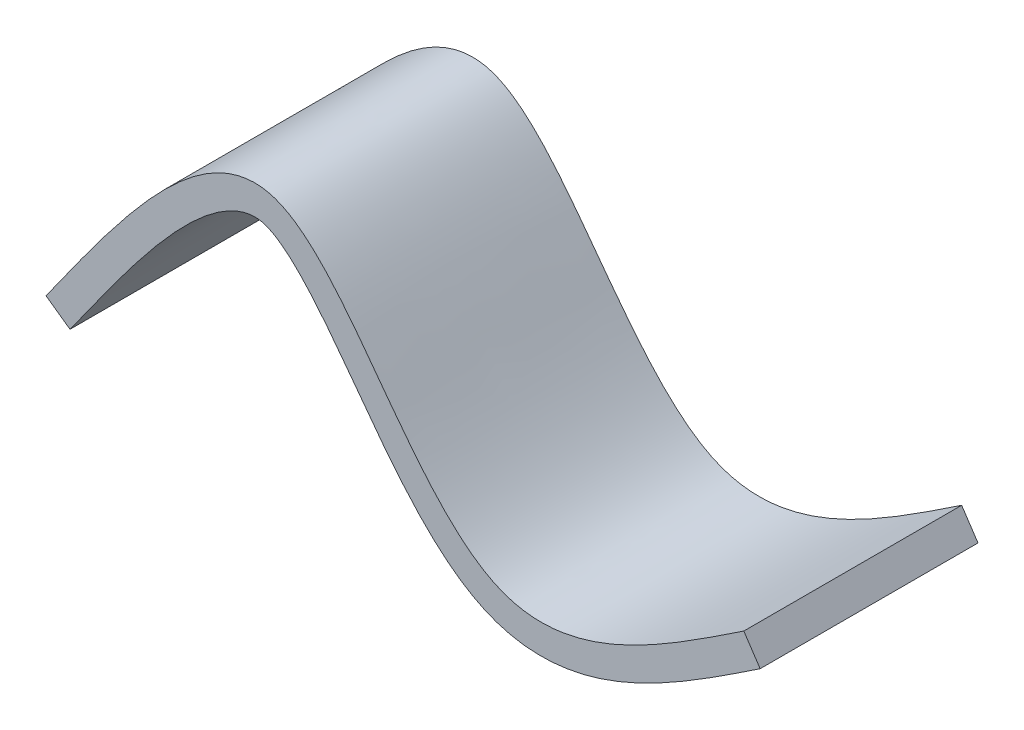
SolidWorks part; units mm, degrees
ref_plane "Front" through (0, 0, 0) normal (0, 0, 1) x (1, 0, 0)
ref_plane "Top" through (0, 0, 0) normal (0, 1, 0) x (1, 0, 0)
ref_plane "Right" through (0, 0, 0) normal (1, 0, 0) x (0, 0, -1)
sketch "Sketch1" plane through (0, 0, 0) normal (0, 0, 1) x (1, 0, 0)
  spline_without_curve S0
surface "Surface-Extrude1" sketch "Sketch1" parameters "D1"=74
thicken "Thicken2" surfaces to thicken 101 thickness 10 parameters "D1"=10
